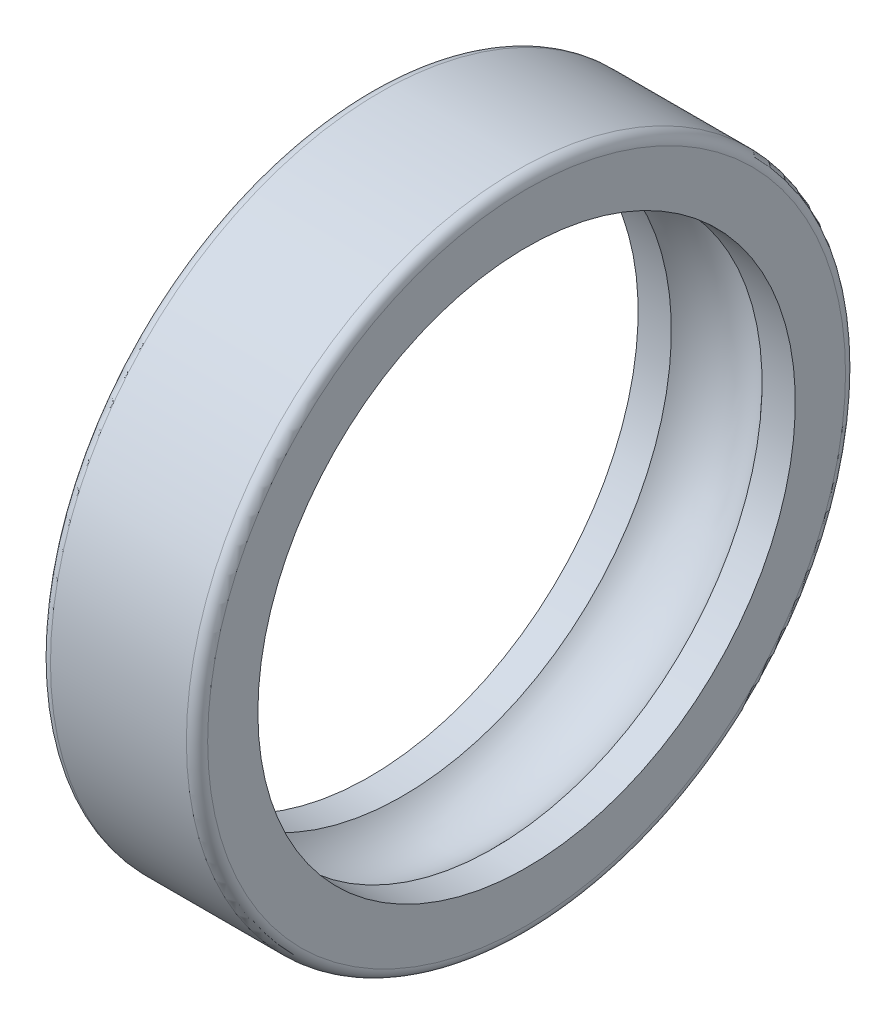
SolidWorks part; units mm, degrees
ref_plane "Front Plane" through (0, 0, 0) normal (0, 0, 1) x (1, 0, 0)
ref_plane "Top Plane" through (0, 0, 0) normal (0, 1, 0) x (1, 0, 0)
ref_plane "Right Plane" through (0, 0, 0) normal (1, 0, 0) x (0, 0, -1)
sketch "Sketch1" plane through (0, 0, 0) normal (0, 0, 1) x (1, 0, 0)
  line L0 (0, 53.5474) -> (0, -22.5594) construction
  line L1 (-19.5668, 0) -> (51.2574, 0) construction
  line L2 (8.9443, 53) -> (15.5, 53)
  line L3 (-15.5, 65) -> (15.5, 65)
  line L4 (-15.5, 65) -> (-15.5, 53)
  line L5 (-15.5, 53) -> (-8.9443, 53)
  line L6 (15.5, 65) -> (15.5, 53)
  line L7 (-15.5, 65) -> (15.5, 53) construction
  line L8 (-15.5, 53) -> (15.5, 65) construction
  arc A0 (-8.9443, 53) -> (8.9443, 53) centre (0, 45) cw
  dimension "D5" = 12
  dimension "D1" = 31
  dimension "D2" = 65
  dimension "D3" = 53
  dimension "D4" = 8
revolve "Revolve1" add sketch "Sketch1" angle 360 about L1
fillet "Fillet1" radius 2.1 2 edges at (15.5, 0, 65) (-15.5, 0, 65)
